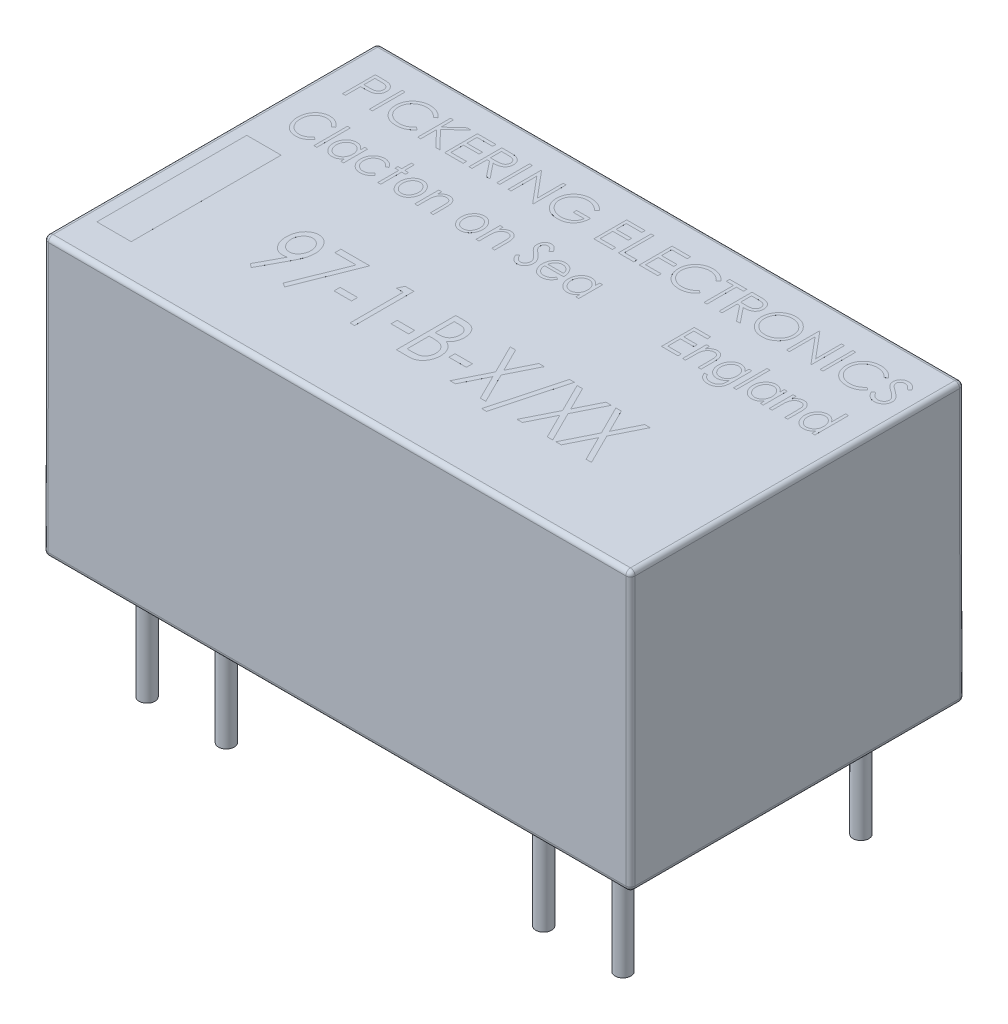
SolidWorks part; units mm, degrees
ref_plane "Front Plane" through (0, 0, 0) normal (0, 0, 1) x (1, 0, 0)
ref_plane "Top Plane" through (0, 0, 0) normal (0, 1, 0) x (1, 0, 0)
ref_plane "Right Plane" through (0, 0, 0) normal (1, 0, 0) x (0, 0, -1)
sketch "Sketch2" plane through (0, 0, 0) normal (0, 1, 0) x (1, 0, 0)
  line L1 (9.4, -5.35) -> (-9.4, -5.35)
  line L2 (9.4, -5.35) -> (9.4, 5.35)
  line L3 (9.4, 5.35) -> (-9.4, 5.35)
  line L4 (-9.4, -5.35) -> (-9.4, 5.35)
  line L5 (9.4, -5.35) -> (-9.4, 5.35) construction
  line L6 (9.4, 5.35) -> (-9.4, -5.35) construction
  point P0 (0, 0)
  dimension "D1" = 10.7
  dimension "D2" = 18.8
extrude "Main body" add sketch "Sketch2" along normal blind 8.892 draft 0.04
sketch "Sketch3" plane through (0, 0, 0) normal (0, -1, 0) x (1, 0, 0)
  line L0 (-9.4, -5.35) -> (-9.4, 5.35) construction
  line L1 (-9.4, 5.35) -> (9.4, 5.35) construction
  line L2 (9.4, -5.35) -> (-9.4, -5.35) construction
  circle A0 centre (-7.62, 3.81) radius 0.254
  circle A1 centre (-7.62, -3.81) radius 0.254
  circle A2 centre (-5.08, 3.81) radius 0.254
  dimension "D1" = 0.508
  dimension "D2" = 1.78
  dimension "D3" = 1.54
  dimension "D4" = 2.54
  dimension "D5" = 1.54
extrude "Left Pins" add sketch "Sketch3" along normal blind 3.808
mirror "Right Pins" about plane through (0, 0, 0) normal (1, 0, 0) of "Left Pins"
sketch "Sketch4" plane through (0, 0, 0) normal (0, -1, 0) x (1, 0, 0)
  line L0 (-9.4, 5.35) -> (9.4, 5.35) construction
  line L1 (-4.75, 4.842) -> (-3.95, 4.842)
  line L2 (-4.75, 4.842) -> (-4.75, -4.842)
  line L3 (-4.75, -4.842) -> (-3.95, -4.842)
  line L4 (-3.95, 4.842) -> (-3.95, -4.842)
  line L5 (9.4, -5.35) -> (-9.4, -5.35) construction
  line L6 (-9.4, -5.35) -> (-9.4, 5.35) construction
  dimension "D1" = 0.508
  dimension "D2" = 0.508
  dimension "D3" = 0.8
  dimension "D4" = 5.45
extrude "Bobbin Foot Left" add sketch "Sketch4" along normal blind 0.508
mirror "Bobbin foot right" about plane through (0, 0, 0) normal (1, 0, 0) of "Bobbin Foot Left"
sketch "Sketch5"
  dimension "D1" = 17.3
  dimension "D2" = 0.7435
  dimension "D3" = 2
  dimension "D4" = 1.9
  dimension "D5" = 11.35
  dimension "D6" = 3.6
  dimension "D7" = 1.1
  dimension "D8" = 4.8
  dimension "D9" = 1.2
  dimension "D10" = 0.5
extrude "Lettering" add sketch "Sketch5" along normal blind 0.0001
fillet "Fillet1" radius 0.15 20 edges at (-4.35, -0.508, 4.842) (-3.95, -0.508, 0) (-4.35, -0.508, -4.842) (-4.75, -0.508, 0) (-9.3969, 4.446, -5.3469) (-9.3938, 8.892, 0) (-9.3969, 4.446, 5.3469) (-9.4, 0, 0) (9.3969, 4.446, 5.3469) (9.3938, 8.892, 0) (9.3969, 4.446, -5.3469) (9.4, 0, 0) (0, 0, -5.35) (0, 8.892, -5.3438) (0, 8.892, 5.3438) (0, 0, 5.35) (4.35, -0.508, -4.842) (3.95, -0.508, 0) (4.35, -0.508, 4.842) (4.75, -0.508, 0)
